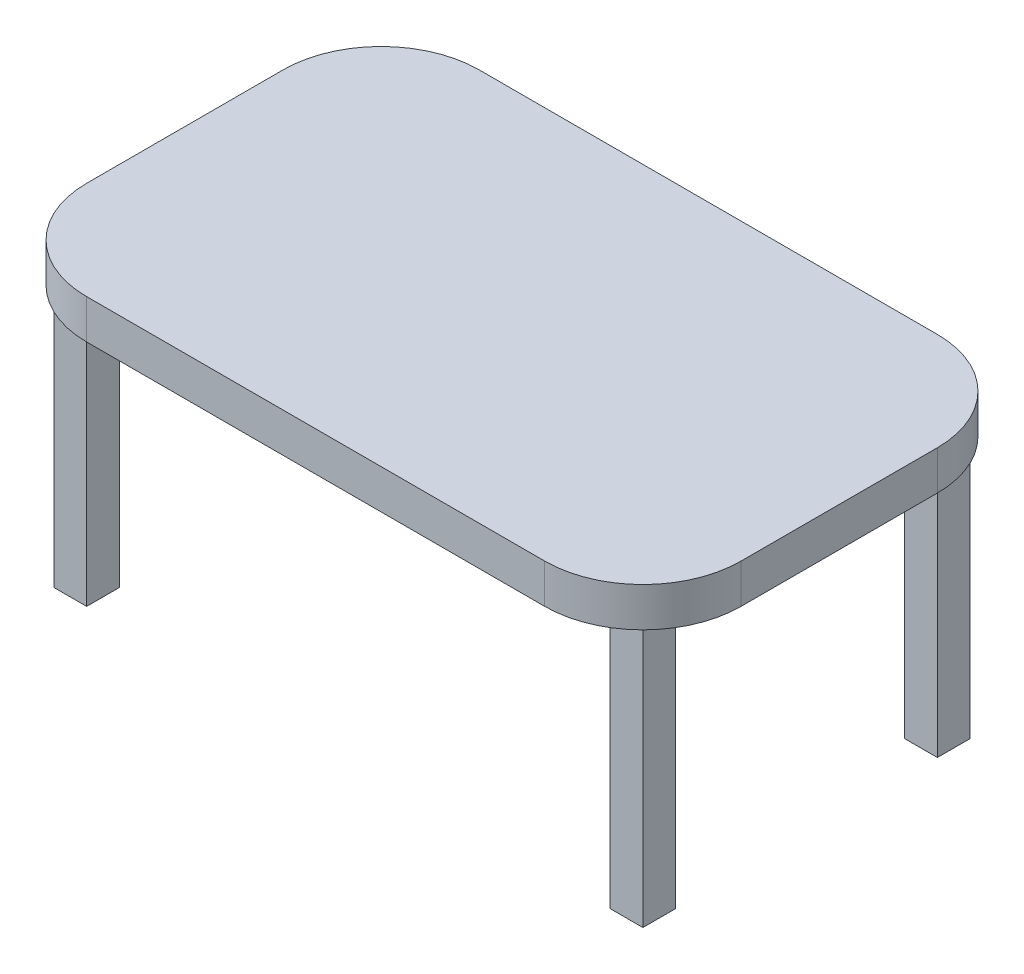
SolidWorks part; units mm, degrees
ref_plane "Plan de face" through (0, 0, 0) normal (0, 0, 1) x (1, 0, 0)
ref_plane "Plan de dessus" through (0, 0, 0) normal (0, 1, 0) x (1, 0, 0)
ref_plane "Plan de droite" through (0, 0, 0) normal (1, 0, 0) x (0, 0, -1)
sketch "Esquisse1" plane through (0, 0, 0) normal (0, 1, 0) x (1, 0, 0)
  line L1 (500, -300) -> (-500, -300)
  line L2 (500, -300) -> (500, 300)
  line L3 (500, 300) -> (-500, 300)
  line L4 (-500, -300) -> (-500, 300)
  line L5 (500, -300) -> (-500, 300) construction
  line L6 (500, 300) -> (-500, -300) construction
  point P0 (0, 0)
  dimension "D1" = 600
  dimension "D2" = 1000
extrude "Boss.-Extru.1" add sketch "Esquisse1" along normal blind 60
sketch "Esquisse2" plane through (0, 0, 0) normal (0, -1, 0) x (1, 0, 0)
  line L0 (-500, 300) -> (500, 300) construction
  line L1 (-450, 250) -> (-400, 250)
  line L2 (-450, 250) -> (-450, 200)
  line L3 (-450, 200) -> (-400, 200)
  line L4 (-400, 250) -> (-400, 200)
  line L5 (-450, 250) -> (-400, 200) construction
  line L6 (-450, 200) -> (-400, 250) construction
  line L7 (-500, -300) -> (-500, 300) construction
  point P0 (-425, 225)
  dimension "D1" = 50
  dimension "D2" = 50
  dimension "D3" = 50
  dimension "D4" = 50
extrude "Boss.-Extru.2" add sketch "Esquisse2" along normal blind 400
mirror "Symétrie1" about plane through (0, 0, 0) normal (1, 0, 0) of "Boss.-Extru.2"
mirror "Symétrie2" about plane through (0, 0, 0) normal (0, 0, 1) of "Symétrie1", "Boss.-Extru.2"
fillet "Congé1" radius 150 4 edges at (500, 30, 300) (500, 30, -300) (-500, 30, 300) (-500, 30, -300)
